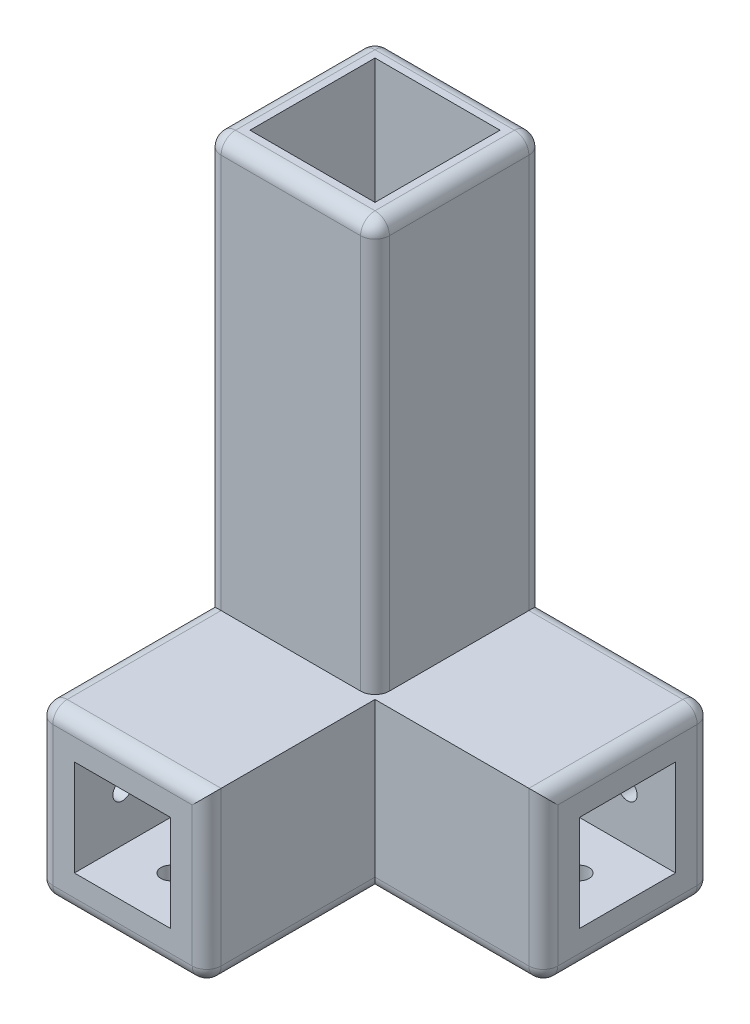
SolidWorks part; units mm, degrees
ref_plane "Alzado" through (0, 0, 0) normal (0, 0, 1) x (1, 0, 0)
ref_plane "Planta" through (0, 0, 0) normal (0, 1, 0) x (1, 0, 0)
ref_plane "Vista lateral" through (0, 0, 0) normal (1, 0, 0) x (0, 0, -1)
sketch "Sketch1" plane through (0, 0, 0) normal (0, 0, 1) x (1, 0, 0)
  line L0 (0, 70) -> (0, 0)
  line L1 (0, 0) -> (70, 0)
  line L2 (70, 0) -> (70, 35)
  line L3 (70, 35) -> (35, 35)
  line L4 (35, 35) -> (35, 70)
  line L5 (35, 70) -> (0, 70)
  dimension "D1" = 70
  dimension "D2" = 70
  dimension "D3" = 35
  dimension "D4" = 35
extrude "Boss-Extrude1" add sketch "Sketch1" along normal blind 35
sketch "Sketch2" plane through (0, 0, 35) normal (0, 0, 1) x (1, 0, 0)
  line L0 (35, 35) -> (0, 35)
  line L1 (0, 70) -> (0, 0) construction
  line L2 (0, 35) -> (0, 0)
  line L3 (0, 0) -> (35, 0)
  line L4 (0, 0) -> (70, 0) construction
  line L5 (35, 0) -> (35, 35)
extrude "Boss-Extrude2" add sketch "Sketch2" along normal blind 35
sketch "Sketch3" plane through (0, 0, 70) normal (0, 0, 1) x (1, 0, 0)
  line L0 (35, 0) -> (35, 35) construction
  line L1 (7.5, 27.5) -> (27.5, 27.5)
  line L2 (7.5, 27.5) -> (7.5, 7.5)
  line L3 (7.5, 7.5) -> (27.5, 7.5)
  line L4 (27.5, 27.5) -> (27.5, 7.5)
  line L5 (7.5, 27.5) -> (27.5, 7.5) construction
  line L6 (7.5, 7.5) -> (27.5, 27.5) construction
  line L7 (0, 0) -> (35, 0) construction
  point P0 (17.5, 17.5)
  dimension "D1" = 17.5
  dimension "D2" = 17.5
  dimension "D3" = 20
  dimension "D4" = 20
sketch "Sketch4" plane through (70, 0, 0) normal (1, 0, 0) x (0, 0, -1)
  line L0 (0, 0) -> (0, 35) construction
  line L1 (-27.5, 27.5) -> (-7.5, 27.5)
  line L2 (-27.5, 27.5) -> (-27.5, 7.5)
  line L3 (-27.5, 7.5) -> (-7.5, 7.5)
  line L4 (-7.5, 27.5) -> (-7.5, 7.5)
  line L5 (-27.5, 27.5) -> (-7.5, 7.5) construction
  line L6 (-27.5, 7.5) -> (-7.5, 27.5) construction
  line L7 (-35, 0) -> (0, 0) construction
  point P0 (-17.5, 17.5)
  dimension "D1" = 20
  dimension "D2" = 20
  dimension "D3" = 17.5
  dimension "D4" = 17.5
extrude "Cut-Extrude1" cut sketch "Sketch3" against normal blind 20 contours L3 L4 L1 L2
extrude "Cut-Extrude2" cut sketch "Sketch4" against normal blind 20 contours L3 L4 L1 L2
fillet "Fillet1" radius 3 14 edges at (35, 0, 0) (70, 17.5, 0) (52.5, 35, 0) (17.5, 35, 70) (0, 0, 35) (0, 17.5, 70) (0, 35, 52.5) (70, 35, 17.5) (70, 17.5, 35) (35, 17.5, 70) (70, 0, 17.5) (52.5, 0, 35) (35, 0, 52.5) (17.5, 0, 70)
sketch "Sketch7" plane through (0, 0, 0) normal (-1, 0, 0) x (0, 0, 1)
  line L1 (67, 0) -> (3, 0) construction
  line L2 (70, 32) -> (70, 3) construction
  circle A0 centre (60, 17.5) radius 2
  dimension "D2" = 4
  dimension "D3" = 17.5
  dimension "D4" = 10
extrude "Cut-Extrude4" cut sketch "Sketch7" against normal blind 10
sketch "Sketch8" plane through (0, 0, 0) normal (0, 0, -1) x (-1, 0, 0)
  line L0 (-70, 3) -> (-70, 32) construction
  line L1 (-67, 35) -> (-35, 35) construction
  circle A0 centre (-60, 17.5) radius 2
  dimension "D1" = 4
  dimension "D2" = 10
  dimension "D3" = 17.5
extrude "Cut-Extrude5" cut sketch "Sketch8" against normal blind 10
sketch "Sketch9" plane through (0, 70, 0) normal (0, 1, 0) x (1, 0, 0)
  line L1 (0, 0) -> (35, 0)
  line L2 (0, 0) -> (0, -35)
  line L3 (0, -35) -> (35, -35)
  line L4 (35, 0) -> (35, -35)
extrude "Boss-Extrude3" add sketch "Sketch9" along normal blind 50
sketch "Sketch10" plane through (0, 120, 0) normal (0, 1, 0) x (1, 0, 0)
  line L0 (35, 0) -> (0, 0) construction
  line L1 (4.5, -4.5) -> (30.5, -4.5)
  line L2 (4.5, -4.5) -> (4.5, -30.5)
  line L3 (4.5, -30.5) -> (30.5, -30.5)
  line L4 (30.5, -4.5) -> (30.5, -30.5)
  line L5 (4.5, -4.5) -> (30.5, -30.5) construction
  line L6 (4.5, -30.5) -> (30.5, -4.5) construction
  line L7 (0, 0) -> (0, -35) construction
  point P0 (17.5, -17.5)
  dimension "D1" = 26
  dimension "D2" = 26
  dimension "D3" = 17.5
  dimension "D4" = 17.5
extrude "Cut-Extrude6" cut sketch "Sketch10" against normal blind 50
fillet "Fillet2" radius 3 9 edges at (0.8787, 0.8787, 0.8787) (0, 61.5, 0) (0, 76, 35) (35, 76, 0) (17.5, 120, 0) (0, 120, 17.5) (17.5, 120, 35) (35, 77.5, 35) (35, 120, 17.5)
sketch "Sketch11" plane through (0, 0, 0) normal (-1, 0, 0) x (0, 0, 1)
  line L0 (35, 117) -> (35, 35) construction
  line L1 (3, 120) -> (32, 120) construction
  circle A0 centre (17.5, 100) radius 2
  dimension "D1" = 4
  dimension "D2" = 17.5
  dimension "D3" = 20
extrude "Cut-Extrude7" cut sketch "Sketch11" against normal blind 20
sketch "Sketch12" plane through (0, 0, 0) normal (0, 0, -1) x (-1, 0, 0)
  line L0 (-32, 120) -> (-3, 120) construction
  line L1 (0, 117) -> (0, 3) construction
  circle A0 centre (-17.5, 100) radius 2
  dimension "D1" = 4
  dimension "D2" = 20
  dimension "D3" = 17.5
extrude "Cut-Extrude8" cut sketch "Sketch12" against normal blind 20
sketch "Sketch13" plane through (0, 0, 0) normal (0, -1, 0) x (1, 0, 0)
  line L0 (67, 0) -> (3, 0) construction
  line L1 (70, 32) -> (70, 3) construction
  line L3 (35, 67) -> (35, 35) construction
  line L4 (3, 70) -> (32, 70) construction
  circle A0 centre (17.5, 60) radius 2
  circle A1 centre (60, 17.5) radius 2
  point P12 (17.1412, 61.9251)
  dimension "D1" = 4
  dimension "D2" = 4
  dimension "D3" = 17.5
  dimension "D4" = 10
  dimension "D5" = 17.5
  dimension "D6" = 10
extrude "Cut-Extrude9" cut sketch "Sketch13" against normal blind 20
